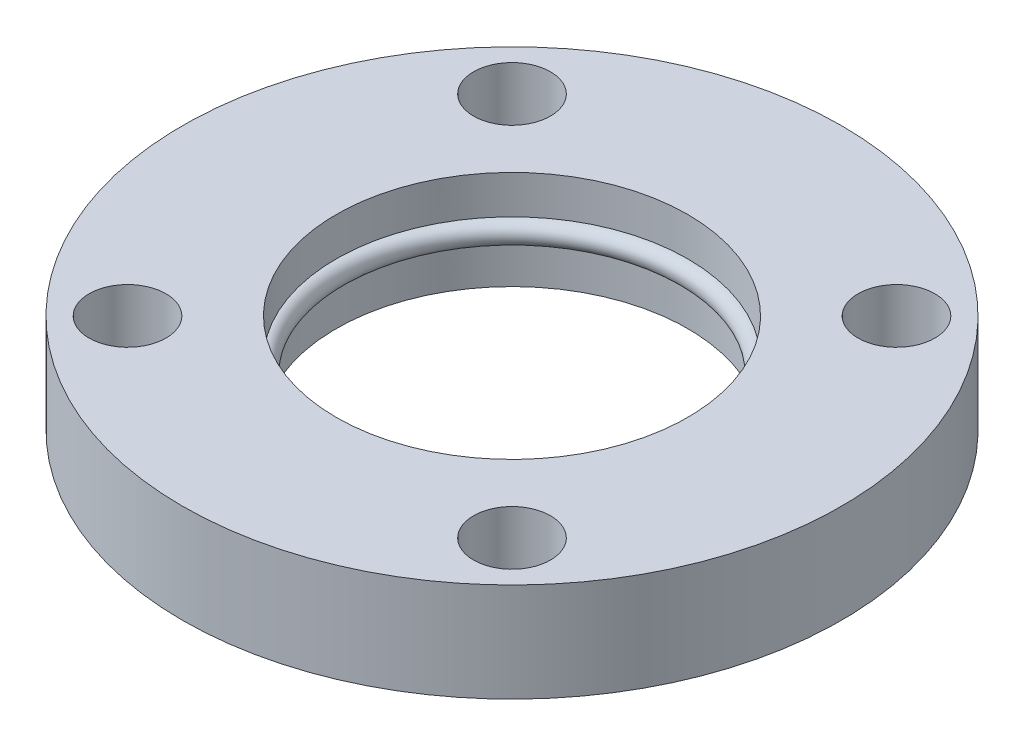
SolidWorks part; units mm, degrees
ref_plane "Front Plane" through (0, 0, 0) normal (0, 0, 1) x (1, 0, 0)
ref_plane "Top Plane" through (0, 0, 0) normal (0, 1, 0) x (1, 0, 0)
ref_plane "Right Plane" through (0, 0, 0) normal (1, 0, 0) x (0, 0, -1)
sketch "Sketch2" plane through (0, 0, 0) normal (0, 1, 0) x (1, 0, 0)
  line L1 (-17.5, -17.5) -> (17.5, -17.5) construction
  line L2 (-17.5, -17.5) -> (-17.5, 17.5) construction
  line L3 (-17.5, 17.5) -> (17.5, 17.5) construction
  line L4 (17.5, -17.5) -> (17.5, 17.5) construction
  line L5 (-17.5, -17.5) -> (17.5, 17.5) construction
  line L6 (-17.5, 17.5) -> (17.5, -17.5) construction
  circle A0 centre (0, 0) radius 16
  circle A1 centre (0, 0) radius 30
  circle A2 centre (-17.5, 17.5) radius 3.5
  circle A3 centre (17.5, 17.5) radius 3.5
  circle A4 centre (17.5, -17.5) radius 3.5
  circle A5 centre (-17.5, -17.5) radius 3.5
  dimension "D1" = 60
  dimension "D2" = 32
  dimension "D4" = 7
  dimension "D3" = 35
extrude "Boss-Extrude1" add sketch "Sketch2" along normal mid plane 9
sketch "Sketch3" plane through (0, 0, 0) normal (0, 0, 1) x (1, 0, 0)
  line L0 (-16, 0) -> (0, 0) construction
  line L1 (0, 0) -> (0, 4.5) construction
  line L2 (30, 4.5) -> (-30, 4.5) construction
  circle A0 centre (-16, 0) radius 1
  dimension "D1" = 2
  dimension "D2" = 32
revolve "Revolve2" add sketch "Sketch3" angle 360 about L1
